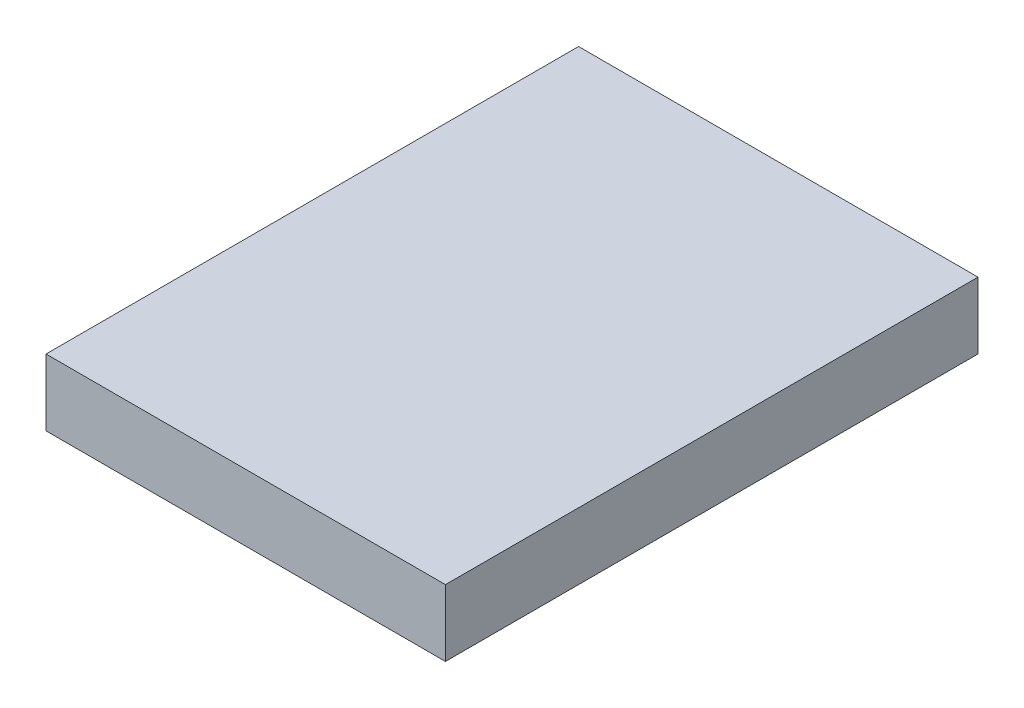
SolidWorks part; units mm, degrees
ref_plane "Plan de face" through (0, 0, 0) normal (0, 0, 1) x (1, 0, 0)
ref_plane "Plan de dessus" through (0, 0, 0) normal (0, 1, 0) x (1, 0, 0)
ref_plane "Plan de droite" through (0, 0, 0) normal (1, 0, 0) x (0, 0, -1)
sketch "Esquisse1" plane through (0, 0, 0) normal (0, 0, 1) x (1, 0, 0)
  line L1 (-15, 2.5) -> (15, 2.5)
  line L2 (-15, 2.5) -> (-15, -2.5)
  line L3 (-15, -2.5) -> (15, -2.5)
  line L4 (15, 2.5) -> (15, -2.5)
  dimension "D1" = 30
  dimension "D2" = 5
  dimension "D3" = 15
  dimension "D4" = 2.5
extrude "Extrusion1" add sketch "Esquisse1" along normal mid plane 40
